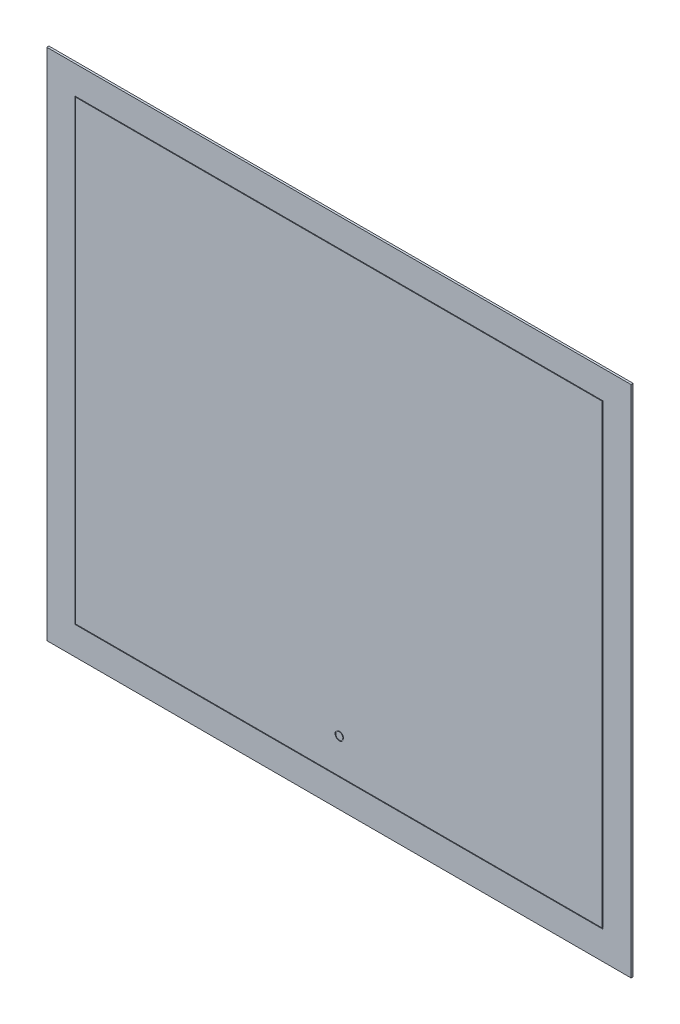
SolidWorks part; units mm, degrees
ref_plane "Alzado" through (0, 0, 0) normal (0, 0, 1) x (1, 0, 0)
ref_plane "Planta" through (0, 0, 0) normal (0, 1, 0) x (1, 0, 0)
ref_plane "Vista lateral" through (0, 0, 0) normal (1, 0, 0) x (0, 0, -1)
sketch "Croquis3" plane through (0, 0, 0) normal (0, 0, 1) x (1, 0, 0)
  line L0 (0, 0) -> (0, 730)
  line L1 (0, 730) -> (830, 730)
  line L2 (830, 730) -> (830, 0)
  line L3 (830, 0) -> (0, 0)
  line L4 (40, 690) -> (790, 690)
  line L5 (790, 690) -> (790, 40)
  line L6 (790, 40) -> (40, 40)
  line L7 (40, 40) -> (40, 690)
  line L8 (41, 41) -> (41, 689)
  line L9 (41, 689) -> (789, 689)
  line L10 (789, 689) -> (789, 41)
  line L11 (789, 41) -> (41, 41)
  dimension "D1" = 730
  dimension "D2" = 830
  dimension "D3" = 40
  dimension "D4" = 1
extrude "Saliente-Extruir1" add sketch "Croquis3" along normal blind 3 contours L3 L2 L1 L0 L6 L7 L4 L5 | L7 L6 L5 L4 L10 L11 L8 L9 | L11 L10 L9 L8
sketch "Croquis5" plane through (0, 0, 3) normal (0, 0, 1) x (1, 0, 0)
  line L4 (41, 689) -> (41, 41)
  line L5 (41, 41) -> (789, 41)
  line L6 (789, 41) -> (789, 689)
  line L7 (789, 689) -> (41, 689)
  line L8 (40, 40) -> (790, 40)
  line L9 (790, 40) -> (790, 690)
  line L10 (790, 690) -> (40, 690)
  line L11 (40, 690) -> (40, 40)
  line L12 (40, 40) -> (790, 40)
  line L13 (790, 40) -> (790, 690)
  line L14 (790, 690) -> (40, 690)
  line L15 (40, 690) -> (40, 40)
  dimension "D1" = 40
  dimension "D2" = 1
extrude "Cortar-Extruir1" cut sketch "Croquis5" against normal blind 1
sketch "Croquis6" plane through (0, 0, 0) normal (0, 0, -1) x (-1, 0, 0)
  line L8 (-795, 35) -> (-35, 35)
  line L9 (-35, 35) -> (-35, 695)
  line L10 (-35, 695) -> (-795, 695)
  line L11 (-795, 695) -> (-795, 35)
  line L12 (-795, 35) -> (-35, 35)
  line L13 (-35, 35) -> (-35, 695)
  line L14 (-35, 695) -> (-795, 695)
  line L15 (-795, 695) -> (-795, 35)
  dimension "D1" = 35
extrude "Saliente-Extruir2" add sketch "Croquis6" along normal blind 30
sketch "Croquis7" plane through (0, 0, -30) normal (0, 0, -1) x (-1, 0, 0)
  line L12 (-794, 694) -> (-794, 36)
  line L13 (-794, 36) -> (-36, 36)
  line L14 (-36, 36) -> (-36, 694)
  line L15 (-36, 694) -> (-794, 694)
  line L16 (-794, 694) -> (-794, 36)
  line L17 (-794, 36) -> (-36, 36)
  line L18 (-36, 36) -> (-36, 694)
  line L19 (-36, 694) -> (-794, 694)
  dimension "D1" = 1
extrude "Cortar-Extruir2" cut sketch "Croquis7" against normal blind 30
sketch "Croquis8" plane through (0, 0, 3) normal (0, 0, 1) x (1, 0, 0)
  line L0 (790, 690) -> (41, 41) construction
  line L1 (40, 690) -> (790, 40) construction
  line L2 (415.5, 365.5) -> (415.5, 90.5) construction
  circle A0 centre (415.5, 90.5) radius 5
  circle A1 centre (415.5, 90.5) radius 6
extrude "Cortar-Extruir3" cut sketch "Croquis8" against normal blind 1
